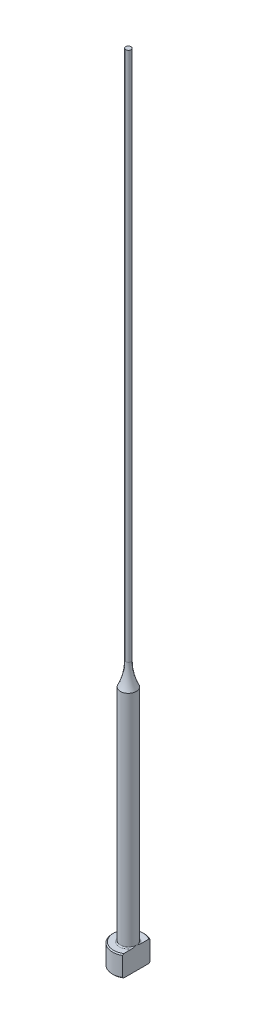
SolidWorks part; units mm, degrees
ref_plane "Front Plane" through (0, 0, 0) normal (0, 0, 1) x (1, 0, 0)
ref_plane "Top Plane" through (0, 0, 0) normal (0, 1, 0) x (1, 0, 0)
ref_plane "Right Plane" through (0, 0, 0) normal (1, 0, 0) x (0, 0, -1)
sketch "Sketch1" plane through (0, 0, 0) normal (0, 0, 1) x (1, 0, 0)
  line L0 (0, 259.9588) -> (0, -15.1925) construction
  line L1 (0, 0) -> (-3, 0)
  line L2 (-3, 0) -> (-3, 4)
  line L3 (-3, 4) -> (-1.5, 4)
  line L4 (-0.5, 50) -> (-0.5, 150)
  line L5 (-0.5, 150) -> (0, 150)
  line L6 (0, 150) -> (0, 0)
  line L7 (-1.5, 4) -> (-1.5, 45.6411)
  arc A0 (-1.5, 45.6411) -> (-0.5, 50) centre (-10.5, 50) ccw
  point P13 (-1.5, 0)
  dimension "D1" = 10
  dimension "L" = 150
  dimension "H" = 6
  dimension "T" = 4
  dimension "D" = 1
  dimension "B" = 3
  dimension "S" = 50
revolve "Revolve1" add sketch "Sketch1" angle 360 about L0
chamfer "Chamfer1" distance 0.2 angle 45 2 edges at (0, 4, 3) (0, 0, 3)
fillet "Fillet1" radius 0.2 1 edges at (0, 4, 1.5)
sketch "Sketch2" plane through (0, 0, 0) normal (0, 1, 0) x (1, 0, 0)
  line L0 (1.5, -2.5981) -> (1.5, 2.5981)
  circle A0 centre (0, 0) radius 3 construction
  arc A1 (1.5, -2.5981) -> (1.5, 2.5981) centre (0, 0) ccw
  circle A2 centre (0, 0) radius 1.5 construction
extrude "Keyed Head" cut sketch "Sketch2" along normal through all
